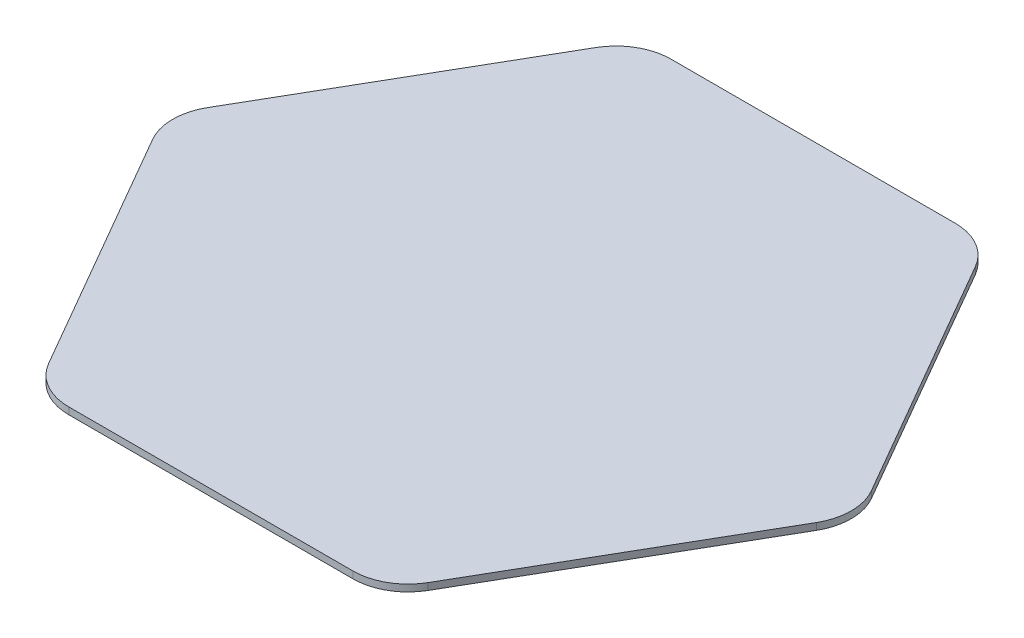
SolidWorks part; units mm, degrees
ref_plane "Plan de face" through (0, 0, 0) normal (0, 0, 1) x (1, 0, 0)
ref_plane "Plan de dessus" through (0, 0, 0) normal (0, 1, 0) x (1, 0, 0)
ref_plane "Plan de droite" through (0, 0, 0) normal (1, 0, 0) x (0, 0, -1)
sketch "Esquisse1" plane through (0, 0, 0) normal (0, 1, 0) x (1, 0, 0)
  line L0 (-55.5122, 80.05) -> (-97.0814, 8.05)
  line L1 (98.7269, 9) -> (57.1577, 81) construction
  line L2 (41.5692, 90) -> (-41.5692, 90) construction
  line L3 (-57.1577, 81) -> (-98.7269, 9) construction
  line L4 (-98.7269, -9) -> (-57.1577, -81) construction
  line L5 (-41.5692, -90) -> (41.5692, -90) construction
  line L6 (57.1577, -81) -> (98.7269, -9) construction
  line L7 (-97.0814, -8.05) -> (-55.5122, -80.05)
  line L8 (-41.5692, -88.1) -> (41.5692, -88.1)
  line L9 (55.5122, -80.05) -> (97.0814, -8.05)
  line L10 (97.0814, 8.05) -> (55.5122, 80.05)
  line L11 (41.5692, 88.1) -> (-41.5692, 88.1)
  circle A0 centre (0, 0) radius 90 construction
  arc A1 (57.1577, 81) -> (41.5692, 90) centre (41.5692, 72) ccw construction
  arc A2 (98.7269, 9) -> (98.7269, -9) centre (83.1384, 0) cw construction
  arc A3 (41.5692, -90) -> (57.1577, -81) centre (41.5692, -72) ccw construction
  arc A4 (-57.1577, -81) -> (-41.5692, -90) centre (-41.5692, -72) ccw construction
  arc A5 (-98.7269, 9) -> (-98.7269, -9) centre (-83.1384, 0) ccw construction
  arc A6 (-41.5692, 90) -> (-57.1577, 81) centre (-41.5692, 72) ccw construction
  arc A7 (-97.0814, 8.05) -> (-97.0814, -8.05) centre (-83.1384, 0) ccw
  arc A8 (-55.5122, -80.05) -> (-41.5692, -88.1) centre (-41.5692, -72) ccw
  arc A9 (41.5692, -88.1) -> (55.5122, -80.05) centre (41.5692, -72) ccw
  arc A10 (97.0814, 8.05) -> (97.0814, -8.05) centre (83.1384, 0) cw
  arc A11 (55.5122, 80.05) -> (41.5692, 88.1) centre (41.5692, 72) ccw
  arc A12 (-41.5692, 88.1) -> (-55.5122, 80.05) centre (-41.5692, 72) ccw
  dimension "D1" = 180
  dimension "D2" = 18
  dimension "D3" = 1.9
extrude "Boss.-Extru.1" add sketch "Esquisse1" along normal blind 2
